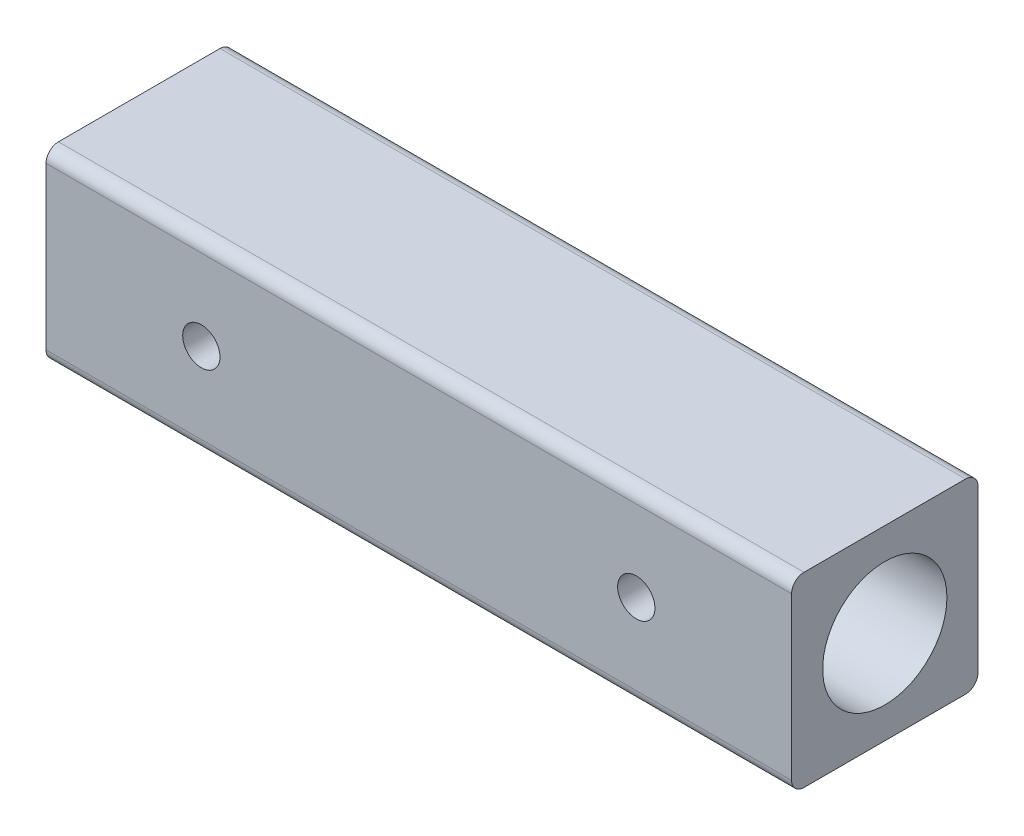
SolidWorks part; units mm, degrees
ref_plane "Front Plane" through (0, 0, 0) normal (0, 0, 1) x (1, 0, 0)
ref_plane "Top Plane" through (0, 0, 0) normal (0, 1, 0) x (1, 0, 0)
ref_plane "Right Plane" through (0, 0, 0) normal (1, 0, 0) x (0, 0, -1)
sketch "Sketch1" plane through (0, 0, 0) normal (1, 0, 0) x (0, 0, -1)
  line L1 (15, -15) -> (-15, -15)
  line L2 (15, -15) -> (15, 15)
  line L3 (15, 15) -> (-15, 15)
  line L4 (-15, -15) -> (-15, 15)
  line L5 (15, -15) -> (-15, 15) construction
  line L6 (15, 15) -> (-15, -15) construction
  point P0 (0, 0)
  dimension "D1" = 30
  dimension "D2" = 30
extrude "Boss-Extrude1" add sketch "Sketch1" along normal blind 120
sketch "Sketch2" plane through (120, 0, 0) normal (1, 0, 0) x (0, 0, -1)
  circle A0 centre (0, 0) radius 10
  dimension "D1" = 20
extrude "Cut-Extrude1" cut sketch "Sketch2" against normal blind 40
sketch "Sketch3" plane through (0, 0, 0) normal (0, 0, 1) x (1, 0, 0)
  line L0 (120, 15) -> (120, -15)
  line L1 (95, 15) -> (95, -15)
  circle A0 centre (95, 0) radius 3
  dimension "D2" = 6
  dimension "D1" = 25
extrude "Cut-Extrude2" cut sketch "Sketch3" against normal mid plane 40 contours L1 A0 | L1 A0
fillet "Fillet1" radius 2 4 edges at (60, -15, 15) (60, -15, -15) (60, 15, -15) (60, 15, 15)
ref_plane "Plane1" through (60, 0, 0) normal (1, 0, 0) x (0, 0, -1)
mirror "Mirror1" about plane through (60, 0, 0) normal (1, 0, 0) of "Cut-Extrude2", "Cut-Extrude1"
